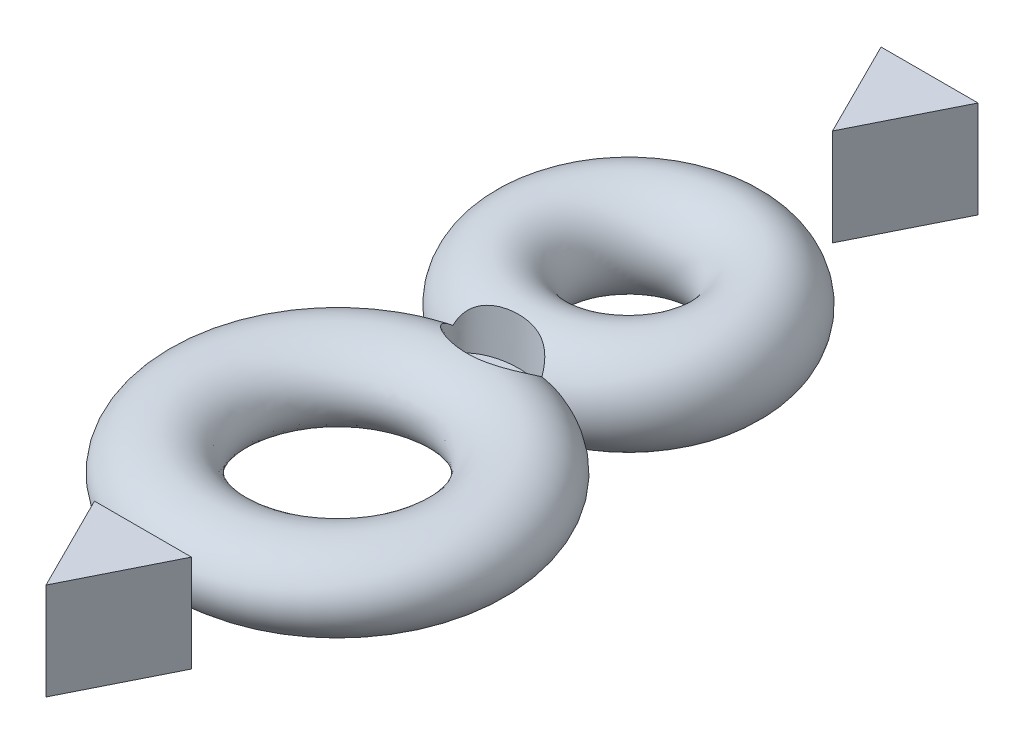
SolidWorks part; units mm, degrees
ref_plane "Front Plane" through (0, 0, 0) normal (0, 0, 1) x (1, 0, 0)
ref_plane "Top Plane" through (0, 0, 0) normal (0, 1, 0) x (1, 0, 0)
ref_plane "Right Plane" through (0, 0, 0) normal (1, 0, 0) x (0, 0, -1)
sketch "Sketch1" plane through (0, 0, 0) normal (1, 0, 0) x (0, 0, -1)
  line L0 (-61.3163, 0) -> (61.3163, 0) construction
  line L1 (-30, 0) -> (-30, 35.4428) construction
  line L2 (15, 0) -> (15, 24.9326) construction
  circle A2 centre (0, 0) radius 7.5
  ellipse E0 centre (-10, 0) end of major axis (-17.5, 0) minor radius 6
  point P15 (0, 0)
  point P16 (-17.8159, 4.5794)
  point P17 (-4.2619, 0)
  dimension "D4" = 20
  dimension "D5" = 15
  dimension "D1" = 122.6327
  dimension "D2" = 12
  dimension "D3" = 15
  dimension "D6" = 15
  dimension "D7" = 10
sketch "Sketch3" plane through (0, 0, 0) normal (1, 0, 0) x (0, 0, -1)
  line L0 (-30, 0) -> (-30, 35.4428) construction
  line L1 (-30, 0) -> (-30, 35.4428) construction
  ellipse E0 centre (-10, 0) end of major axis (-17.5, 0) minor radius 6 construction
  ellipse E1 centre (-10, 0) end of major axis (-17.5, 0) minor radius 6
sketch "Sketch4" plane through (0, 0, 0) normal (1, 0, 0) x (0, 0, -1)
  line L0 (15, 0) -> (15, 24.9326) construction
  line L1 (15, 0) -> (15, 24.9326) construction
  circle A1 centre (0, 0) radius 7.5 construction
  circle A2 centre (0, 0) radius 7.5
revolve "Revolve4" add sketch "Sketch3" angle 360 about L1
revolve "Revolve5" add sketch "Sketch4" angle 360 about L1
sketch "Sketch5" [suppressed] plane through (0, 0, 0) normal (0, 1, 0) x (1, 0, 0)
  line L0 (-7.5, 57) -> (0, 42)
  line L1 (0, 42) -> (7.5, 57)
  line L2 (7.5, 57) -> (-7.5, 57)
  line L3 (0, 42) -> (0, 0) construction
  dimension "D1" = 42
  dimension "D2" = 15
  dimension "D3" = 15
extrude "Boss-Extrude1" [suppressed] add sketch "Sketch5" along normal mid plane 10 separate body
sketch "Sketch6" [suppressed] plane through (0, 0, 0) normal (0, 1, 0) x (1, 0, 0)
  line L3 (34, 7.5) -> (34, -7.5)
  line L4 (34, -7.5) -> (49, 0)
  line L5 (49, 0) -> (34, 7.5)
  line L6 (-7.5, -58) -> (7.5, -58)
  line L7 (7.5, -58) -> (0, -73)
  line L8 (0, -73) -> (-7.5, -58)
  line L9 (-34, -7.5) -> (-49, 0)
  line L10 (0, 0) -> (34, 0) construction
  line L11 (0, 0) -> (0, -58) construction
  line L12 (-34, 7.5) -> (-34, -7.5)
  line L13 (-49, 0) -> (-34, 7.5)
  point P14 (0, 0)
  point P15 (0, -58)
  dimension "D1" = 15
  dimension "D2" = 15
  dimension "D3" = 34
  dimension "D4" = 58
  dimension "D5" = 15
extrude "Boss-Extrude2" [suppressed] add sketch "Sketch6" along normal blind 10 separate body
sketch "Sketch7" plane through (0, 0, 0) normal (0, 1, 0) x (1, 0, 0)
  line L0 (0, -6) -> (0, 0) construction
  ellipse E0 centre (0, -6) end of major axis (7, -6) minor radius 4
  dimension "D1" = 8
  dimension "D2" = 14
  dimension "D3" = 6
extrude "Cut-Extrude1" cut sketch "Sketch7" along normal blind 10
sketch "Sketch8" plane through (0, 0, 0) normal (0, 1, 0) x (1, 0, 0)
  line L0 (-7.5, 61.577) -> (0, 46.577)
  line L1 (0, 46.577) -> (7.5, 61.577)
  line L2 (7.5, 61.577) -> (-7.5, 61.577)
  line L3 (0, 46.577) -> (0, 0) construction
  line L4 (0, 0) -> (0, -60.0979) construction
  line L5 (-7.5, -60.0979) -> (7.5, -60.0979)
  line L6 (7.5, -60.0979) -> (0, -75.0979)
  line L7 (0, -75.0979) -> (-7.5, -60.0979)
  dimension "D1" = 15
  dimension "D2" = 15
  dimension "D3" = 15
  dimension "D4" = 15
extrude "Boss-Extrude3" add sketch "Sketch8" along normal mid plane 15 separate body
